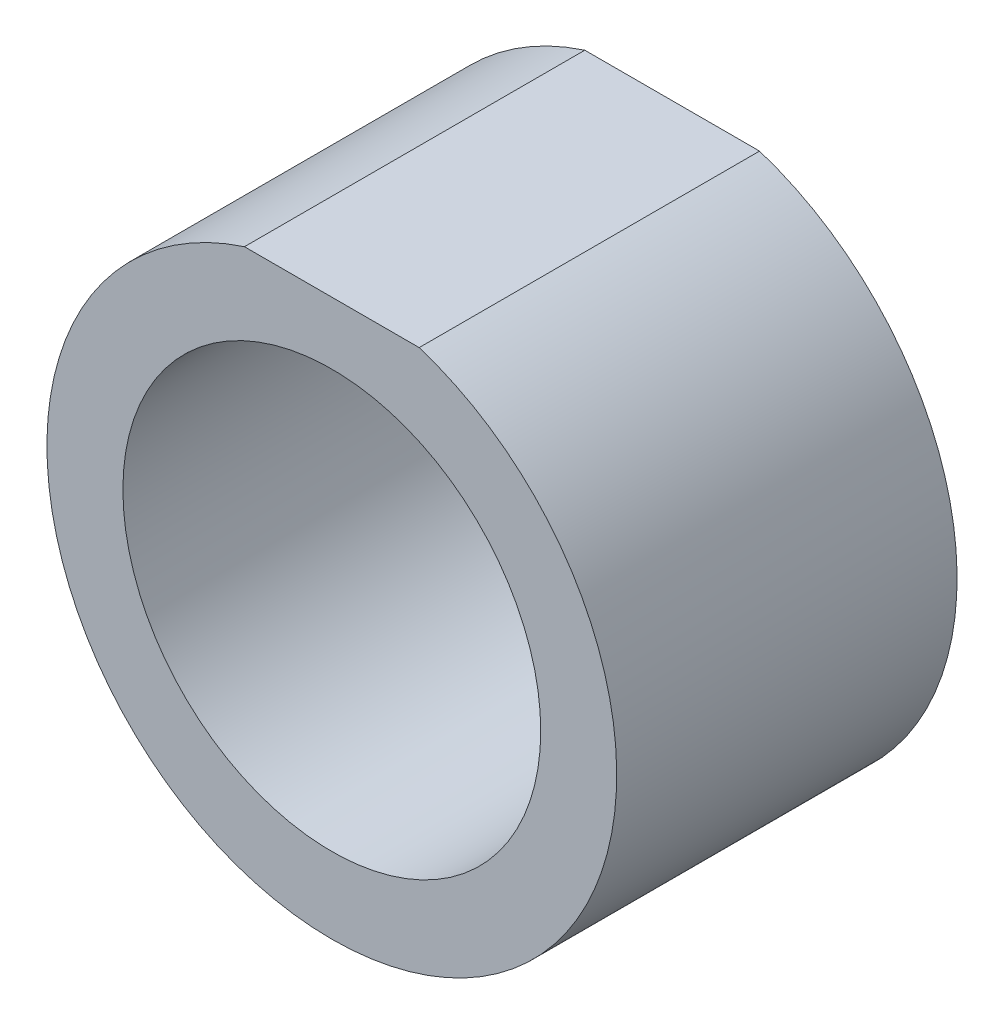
SolidWorks part; units mm, degrees
ref_plane "Front" through (0, 0, 0) normal (0, 0, 1) x (1, 0, 0)
ref_plane "Top" through (0, 0, 0) normal (0, 1, 0) x (1, 0, 0)
ref_plane "Right" through (0, 0, 0) normal (1, 0, 0) x (0, 0, -1)
sketch "Sketch1" plane through (0, 0, 0) normal (0, 0, 1) x (1, 0, 0)
  circle A0 centre (0, 0) radius 9.525
  circle A1 centre (0, 0) radius 6.985
  dimension "D1" = 13.97
  dimension "D2" = 19.05
extrude "Extrude1" add sketch "Sketch1" along normal blind 11.3792
sketch "Sketch2" plane through (0, 0, 11.3792) normal (0, 0, 1) x (1, 0, 0)
  line L0 (-2.921, 9.0661) -> (2.921, 9.0661)
  line L1 (2.921, 9.0661) -> (0, 10.3714)
  line L2 (0, 10.3714) -> (-2.921, 9.0661)
  line L3 (0, 0) -> (0, 9.0661) construction
  circle A0 centre (0, 0) radius 9.525 construction
  dimension "D1" = 5.842
extrude "Cut-Extrude1" cut sketch "Sketch2" against normal through all
